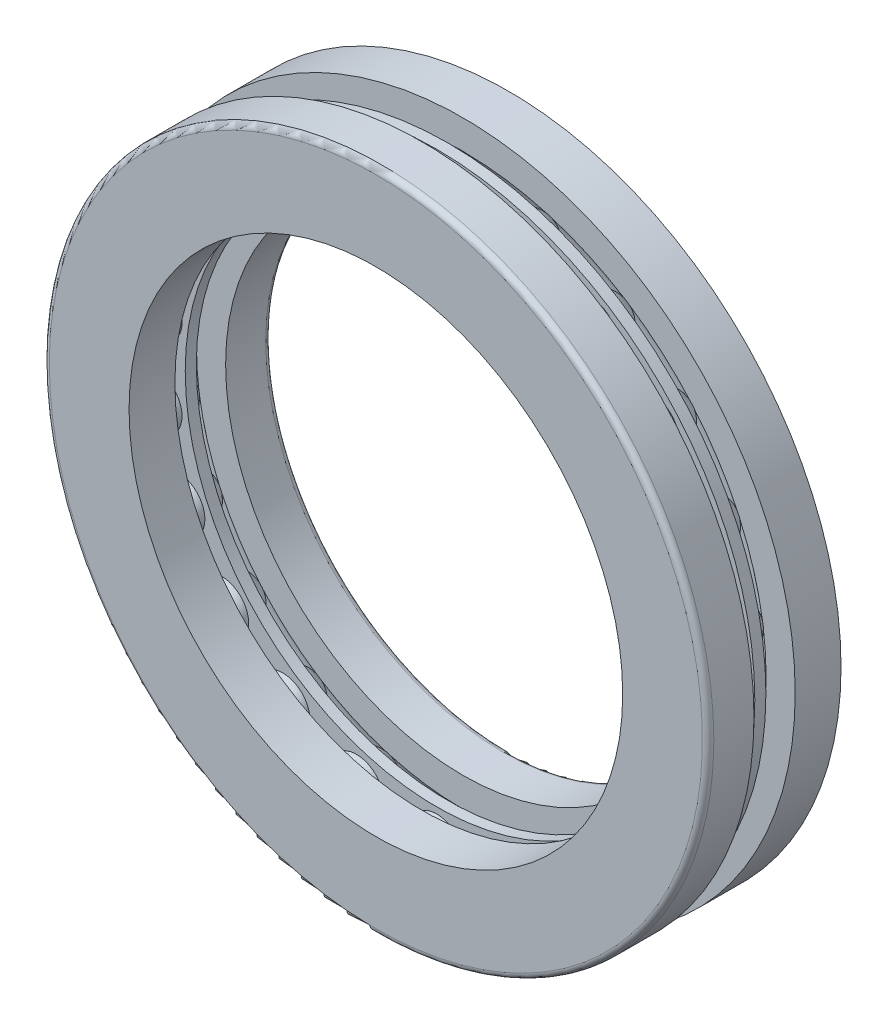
SolidWorks part; units mm, degrees
ref_plane "Front Plane" through (0, 0, 0) normal (0, 0, 1) x (1, 0, 0)
ref_plane "Top Plane" through (0, 0, 0) normal (0, 1, 0) x (1, 0, 0)
ref_plane "Right Plane" through (0, 0, 0) normal (1, 0, 0) x (0, 0, -1)
sketch "BaseSke" plane through (0, 0, 0) normal (1, 0, 0) x (0, 0, -1)
  line L0 (-22.7078, 0) -> (24.6132, 0) construction
  line L1 (-22.7078, 30) -> (24.6132, 30) construction
  line L2 (0, 129.5214) -> (0, -86.3012) construction
  line L3 (0, 32.9167) -> (0, 27.0833)
  line L6 (-7, 35) -> (-7, 26) construction
  line L8 (7, 35) -> (7, 25) construction
  arc A0 (0, 32.9167) -> (0, 27.0833) centre (0, 30) ccw
  dimension "D2" = 7
  dimension "Ball_diameter" = 5.8333
  dimension "D1" = 30
  dimension "Bearing_Thickness" = 14
  dimension "Diameter2" = 70
  dimension "Bearing_Inside_Diameter" = 50
  dimension "Diameter1" = 52
  dimension "Bearing_Outside_Diameter" = 70
revolve "Ball" add sketch "BaseSke" angle 360 about L3
sketch "InnerRaceSke" plane through (0, 0, 0) normal (1, 0, 0) x (0, 0, -1)
  line L0 (2.1724, 28.0689) -> (2.1724, 25)
  line L1 (2.1724, 35) -> (7, 35)
  line L2 (2.1724, 35) -> (2.1724, 31.9311)
  line L3 (2.1724, 25) -> (7, 25)
  line L4 (7, 35) -> (7, 25)
  line L5 (-18.959, 0) -> (19.5136, 0) construction
  arc A0 (2.1724, 28.0689) -> (2.1724, 31.9311) centre (0, 30) ccw
  arc A2 (0, 32.9167) -> (0, 27.0833) centre (0, 30) ccw construction
  dimension "D1" = 5.8133
  dimension "D2" = 4.8276
revolve "InnerRace" add sketch "InnerRaceSke" angle 360 about L5
sketch "OuterRaceSke" plane through (0, 0, 0) normal (1, 0, 0) x (0, 0, -1)
  line L0 (-2.1724, 28.0689) -> (-2.1724, 26)
  line L1 (-7, 35) -> (-2.1724, 35)
  line L2 (-7, 35) -> (-7, 26)
  line L3 (-7, 26) -> (-2.1724, 26)
  line L4 (-2.1724, 35) -> (-2.1724, 31.9311)
  line L5 (-27.1643, 0) -> (37.3715, 0) construction
  arc A0 (-2.1724, 31.9311) -> (-2.1724, 28.0689) centre (0, 30) ccw
  arc A1 (0, 32.9167) -> (0, 27.0833) centre (0, 30) ccw construction
  dimension "D1" = 5.8133
  dimension "D2" = 4.8276
revolve "OuterRace" add sketch "OuterRaceSke" angle 360 about L5
fillet "Fillet1" radius 0.6 2 edges at (35, 0, 7) (25, 0, -7)
pattern_circular "CirPatternBall" count 22 over 360 about axis through (0, 0, 0) along (0, 0, 1) of "Ball"
sketch "CageSke" plane through (0, 0, 0) normal (1, 0, 0) x (0, 0, -1)
  line L0 (0, 59.1614) -> (0, 0) construction
  line L1 (0.5833, 33.5) -> (-0.5833, 33.5)
  line L2 (0.5833, 33.5) -> (0.5833, 26.5)
  line L3 (0.5833, 26.5) -> (-0.5833, 26.5)
  line L4 (-0.5833, 33.5) -> (-0.5833, 26.5)
  line L5 (-23.077, 0) -> (28.998, 0) construction
  circle A0 centre (0, 30) radius 3.5483 construction
  arc A1 (0, 32.9167) -> (0, 27.0833) centre (0, 30) ccw construction
  dimension "D1" = 1.1667
  dimension "D2" = 7
revolve "Cage" add sketch "CageSke" angle 360 about L5
sketch "SimplifiedSke" plane through (0, 0, 0) normal (1, 0, 0) x (0, 0, -1)
  line L0 (-32.3536, 0) -> (41.9236, 0) construction
  circle A0 centre (0, 30) radius 2.9167
  arc A1 (0, 32.9167) -> (0, 27.0833) centre (0, 30) ccw construction
revolve "Simplified" [suppressed] add sketch "SimplifiedSke" angle 360 about L0
equation "\"D2@BaseSke\" = \"Bearing_Thickness@BaseSke\"/2"
equation "\"D1@BaseSke\" =  ( \"Diameter2@BaseSke\" + \"Bearing_Inside_Diameter@BaseSke\" )  / 4"
equation "\"Ball_diameter@BaseSke\" = \"Bearing_Thickness@BaseSke\"  / 2.4"
equation "\"D1@InnerRaceSke\" = \"Ball_diameter@BaseSke\"-0.02"
equation "\"D2@InnerRaceSke\" = \"Bearing_Thickness@BaseSke\"/2.9"
equation "\"D1@OuterRaceSke\" = \"Ball_diameter@BaseSke\"-0.02"
equation "\"D2@OuterRaceSke\" = \"Bearing_Thickness@BaseSke\" / 2.9"
equation "\"D1@CirPatternBall\" =  pi  * \"D1@BaseSke\" * 2 / \"Ball_diameter@BaseSke\"/1.5"
equation "\"D1@CageSke\" = \"Ball_diameter@BaseSke\"/5"
equation "\"D2@CageSke\" = \"Ball_diameter@BaseSke\" * 1.2"
